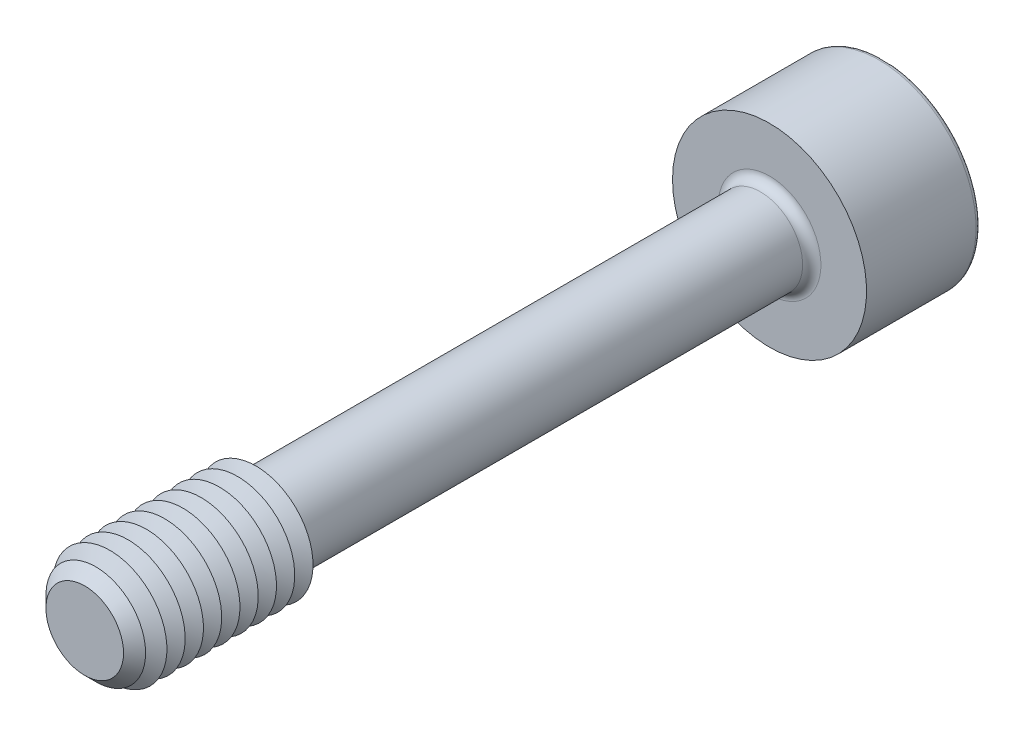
SolidWorks part; units mm, degrees
ref_plane "Front Plane" through (0, 0, 0) normal (0, 0, 1) x (1, 0, 0)
ref_plane "Top Plane" through (0, 0, 0) normal (0, 1, 0) x (1, 0, 0)
ref_plane "Right Plane" through (0, 0, 0) normal (1, 0, 0) x (0, 0, -1)
sketch "Sketch1" plane through (0, 0, 0) normal (0, 0, 1) x (1, 0, 0)
  circle A0 centre (0, 0) radius 1.85
  dimension "D1" = 3.7
extrude "Extrude1" add sketch "Sketch1" along normal mid plane 30
sketch "Sketch2" plane through (0, 0, 0) normal (1, 0, 0) x (0, 0, -1)
  line L0 (-15, 0) -> (-15, 2.5)
  line L1 (-15, 1.85) -> (-15, -1.85) construction
  line L2 (-15, 2.5) -> (-7.5, 2.5)
  line L3 (-7.5, 2.5) -> (-7.1247, 1.85)
  line L4 (15, 1.85) -> (-15, 1.85) construction
  line L5 (-7.1247, 1.85) -> (-7.1247, 0)
  line L6 (-7.1247, 0) -> (-15, 0)
  dimension "D1" = 2.5
  dimension "D2" = 120
  dimension "D3" = 7.5
revolve "Revolve1" add sketch "Sketch2" angle 360 about L6
chamfer "Chamfer1" distance 0.8 angle 45 1 edges at (0, 2.5, 15)
sketch "Sketch3" plane through (0, 0, -15) normal (0, 0, -1) x (-1, 0, 0)
  circle A0 centre (0, 0) radius 4.25
  dimension "D1" = 8.5
extrude "Extrude2" add sketch "Sketch3" along normal blind 5
sketch "Sketch4" plane through (-13.7, 0, -20) normal (0, 0, 1) x (1, 0, 0)
  line L2 (12.5453, -2) -> (14.8547, -2)
  line L3 (14.8547, -2) -> (16.0094, 0)
  line L4 (16.0094, 0) -> (14.8547, 2)
  line L6 (14.8547, 2) -> (12.5453, 2)
  line L7 (12.5453, 2) -> (11.3906, 0)
  line L8 (11.3906, 0) -> (12.5453, -2)
  circle A0 centre (13.7, 0) radius 2 construction
  dimension "D1" = 4
extrude "Extrude3" cut sketch "Sketch4" along normal blind 4
fillet "Fillet1" radius 0.4 1 edges at (-1.85, 0, -15)
fillet "Fillet2" radius 0.2 1 edges at (-4.25, 0, -20)
sketch "Sketch5" plane through (0, 0, 0) normal (1, 0, 0) x (0, 0, -1)
  line L0 (16, 0) -> (16, -2)
  line L1 (16, -2) -> (14.8453, 0)
  line L2 (14.8453, 0) -> (16, 0)
  dimension "D1" = 30
revolve "Cut-Revolve1" cut sketch "Sketch5" angle 360 about L2
sketch "Sketch6" plane through (0, 0, 0) normal (1, 0, 0) x (0, 0, -1)
  line L0 (1.332, 0) -> (-13.289, 0) construction
sketch "Sketch7" plane through (0, 0, 0) normal (1, 0, 0) x (0, 0, -1)
  line L0 (-7.5, 2.5) -> (-7.9, 1.8072)
  line L1 (-7.9, 1.8072) -> (-8.3, 2.5)
  line L2 (-7.5, 2.5) -> (-14.2, 2.5) construction
  line L3 (-8.3, 2.5) -> (-7.5, 2.5)
  dimension "D1" = 0.8
revolve "Cut-Revolve2" cut sketch "Sketch7" angle 360 about L0
pattern_linear "LPattern1" count 9 spacing 0.8 along (0, 0, 1) of "Cut-Revolve2"
